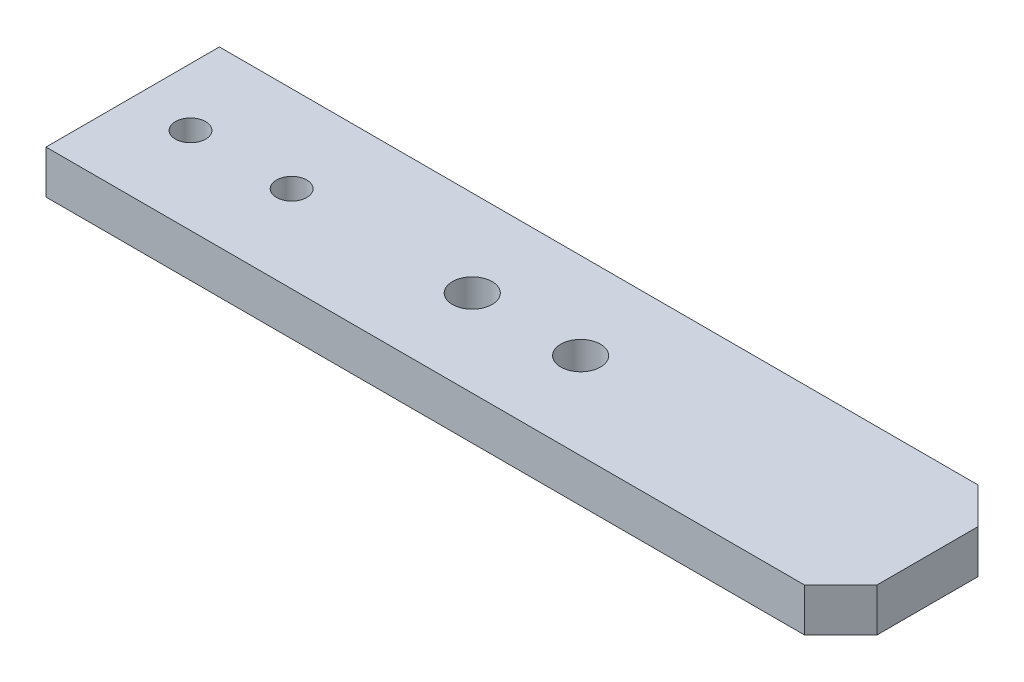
SolidWorks part; units mm, degrees
ref_plane "Front Plane" through (0, 0, 0) normal (0, 0, 1) x (1, 0, 0)
ref_plane "Top Plane" through (0, 0, 0) normal (0, 1, 0) x (1, 0, 0)
ref_plane "Right Plane" through (0, 0, 0) normal (1, 0, 0) x (0, 0, -1)
sketch "Sketch1" plane through (0, 0, 0) normal (0, 1, 0) x (1, 0, 0)
  line L0 (0, 12) -> (110, 12) construction
  line L1 (0, 0) -> (105, 0)
  line L2 (0, 0) -> (0, 24)
  line L3 (0, 24) -> (105, 24)
  line L4 (110, 5) -> (110, 19)
  line L5 (105, 24) -> (110, 19)
  line L6 (105, 0) -> (110, 5)
  circle A0 centre (47, 12) radius 2.75
  circle A1 centre (62, 12) radius 2.75
  point P1 (110, 24)
  point P3 (110, 0)
  dimension "D2" = 5.5
  dimension "D4" = 15
  dimension "D5" = 47
  dimension "D1" = 24
  dimension "D3" = 48
  dimension "D8" = 5
  dimension "D9" = 5
extrude "Extrude1" add sketch "Sketch1" along normal blind 6
sketch "Sketch2" plane through (0, 6, 0) normal (0, 1, 0) x (1, 0, 0)
  line L0 (0, 12) -> (47, 12) construction
  line L1 (0, 24) -> (0, 0) construction
  point P5 (8, 12)
  point P6 (22, 12)
  dimension "D1" = 8
  dimension "D2" = 14
hole_wizard "M5 Tapped Hole1" positions "3DSketch1" profile "Sketch3" tap size "M5" standard "ISO"
sketch3d "3DSketch1"
  point P0 (8, 6, -12)
  point P3 (22, 6, -12)
sketch "Sketch3" plane through (8, 6, -12) normal (1, 0, 0) x (0, 0, 1)
  line L0 (0, 0) -> (0, 6)
  line L1 (0, 6) -> (2.1, 6)
  line L2 (2.1, 6) -> (2.1, 0)
  line L5 (2.1, 0) -> (0, 0)
  line L11 (0, -6.35) -> (0, 107.95) construction
  dimension "Thru Tap Drill Dia." = 4.2
  dimension "Thru Tap Drill Depth" = 6
